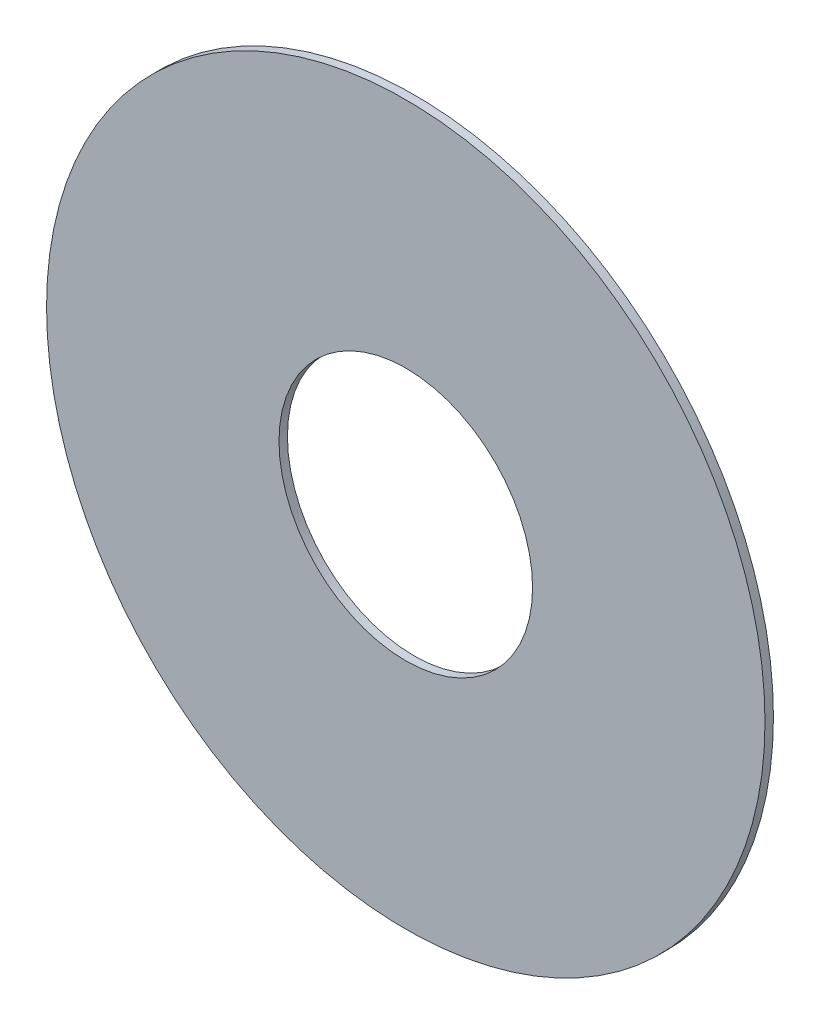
SolidWorks part; units mm, degrees
ref_plane "Face" through (0, 0, 0) normal (0, 0, 1) x (1, 0, 0)
ref_plane "Dessus" through (0, 0, 0) normal (0, 1, 0) x (1, 0, 0)
ref_plane "Droite" through (0, 0, 0) normal (1, 0, 0) x (0, 0, -1)
ref_plane "Plan4" through (0, 0, -0.2) normal (0, 0, -1) x (-1, 0, 0)
sketch "Esquisse1" plane through (0, 0, -0.2) normal (0, 0, -1) x (-1, 0, 0)
  circle A0 centre (0, 0) radius 3
  circle A1 centre (0, 0) radius 8.5
extrude "Base-Extrusion" add sketch "Esquisse1" against normal blind 0.2
